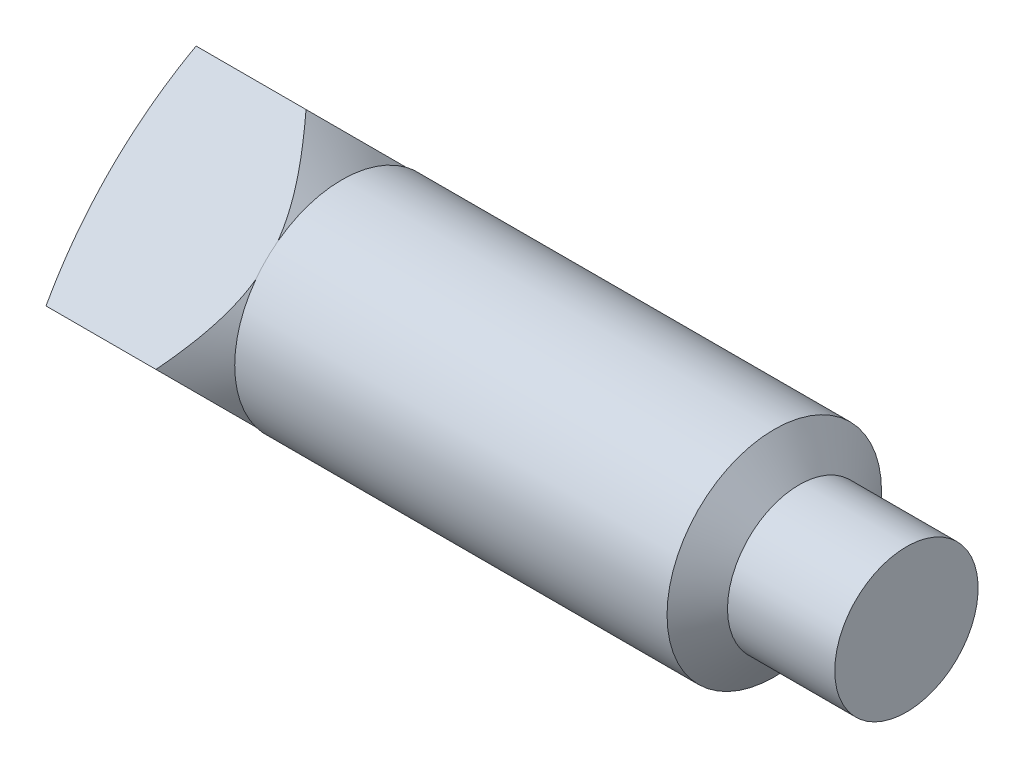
SolidWorks part; units mm, degrees
ref_plane "Plane1" through (0, 0, 0) normal (0, 0, 1) x (1, 0, 0)
ref_plane "Plane2" through (0, 0, 0) normal (0, 1, 0) x (1, 0, 0)
ref_plane "Plane3" through (0, 0, 0) normal (1, 0, 0) x (0, 0, -1)
sketch "BodySke" plane through (0, 0, 0) normal (0, 0, 1) x (1, 0, 0)
  line L0 (10.287, -1.6129) -> (12.7, -1.6129) construction
  line L1 (0, 0) -> (0, 2.413)
  line L2 (0, 2.413) -> (9.7268, 2.413)
  line L3 (12.7, 1.6129) -> (12.7, 0)
  line L4 (12.7, 0) -> (0, 0)
  line L5 (0, 0) -> (34.4106, 0) construction
  line L6 (0.7874, 3.175) -> (0.7874, -1.6129) construction
  line L7 (10.287, 1.6129) -> (12.7, 1.6129)
  line L8 (0, -2.413) -> (10.287, -2.413) construction
  line L9 (10.287, 1.6129) -> (9.7268, 2.413)
  line L10 (-2.413, 6.35) -> (-2.413, -1.6129) construction
  dimension "D1" = 125
  dimension "Length" = 12.7
  dimension "Diameter" = 4.826
  dimension "Dog_dia" = 3.2258
  dimension "Dog_len" = 2.413
  dimension "Advance" = 0.7874
  dimension "Thread_nom" = 12.7
revolve "BaseBody" add sketch "BodySke"
pattern_linear "ThdSchPat" [suppressed]
revolve "ThreadSchematic" cut sketch "ThdSchSke" angle 360 about L5
sketch "ThdSchSke" plane through (0, 0, 0) normal (0, 0, 1) x (1, 0, 0)
  line L0 (0.7874, -1.9406) -> (0.4566, -2.413)
  line L1 (0.7874, -1.9406) -> (1.1182, -2.413)
  line L2 (1.1182, -2.413) -> (1.1182, -3.0163)
  line L3 (-3.175, 0) -> (5.1513, 0) construction
  line L5 (1.1182, -3.0163) -> (0.4566, -3.0163)
  line L6 (0.4566, -3.0163) -> (0.4566, -2.413)
  dimension "D1" = 360
  dimension "Thread_minor" = 3.8811
  dimension "D2" = 1
  dimension "Diameter" = 4.826
  dimension "Start" = 0.7874
  dimension "D4" = 50
  dimension "SideAngle" = 55
  dimension "VeeAngle" = 70
  dimension "Overcut" = 6.0325
  dimension "Num_threads" = 13
  dimension "Advance" = 0.7307
sketch "Sketch4" plane through (0, 0, 0) normal (-1, 0, 0) x (0, -0.7071, 0.7071)
  line L1 (-2.3876, -2.3876) -> (2.3876, -2.3876)
  line L2 (-2.3876, -2.3876) -> (-2.3876, 2.3876)
  line L3 (-2.3876, 2.3876) -> (2.3876, 2.3876)
  line L4 (2.3876, -2.3876) -> (2.3876, 2.3876)
  dimension "D1" = 4.7752
  dimension "Width_flats" = 4.7752
  dimension "D2" = 2.3876
  dimension "D3" = 2.3876
extrude "BaseHead" add sketch "Sketch4" along normal blind 3.7592
sketch "Sketch5" plane through (0, 0, 0) normal (0, 0, 1) x (1, 0, 0)
  line L0 (-3.7592, 0) -> (-16.4592, 0)
  line L1 (0, 0) -> (57.15, 0) construction
  line L2 (0, 0) -> (34.4106, 0) construction
  line L3 (-16.4592, 0) -> (-16.4592, 3.3766)
  line L5 (-16.4592, 3.3766) -> (-3.2823, 3.3766)
  line L6 (-3.7592, 3.3766) -> (0, 3.3766) construction
  arc A0 (-3.2823, 3.3766) -> (-3.7592, 0) centre (8.4328, 0) ccw
  dimension "Head_radius" = 12.192
  dimension "D2" = 8.4328
  dimension "D3" = 12.7
revolve "HeadCrown" cut sketch "Sketch5" angle 360 about L1
sketch "Sketch6" plane through (0, 0, 0) normal (0, 0, 1) x (1, 0, 0)
  line L0 (0, 2.413) -> (-0.8085, 3.3766)
  line L1 (12.7, 2.413) -> (0, 2.413)
  line L3 (0, 1.9352) -> (0, 3.3766) construction
  line L4 (-3.2823, 3.3766) -> (0, 3.3766) construction
  line L5 (-0.8085, 3.3766) -> (-0.8085, 16.0766)
  line L7 (12.7, 2.413) -> (12.7, 16.0766)
  line L8 (12.7, 16.0766) -> (-0.8085, 16.0766)
  line L9 (0, 0) -> (60.325, 0) construction
  dimension "D1" = 40
  dimension "D2" = 12.7
  dimension "D3" = 12.7
  dimension "D4" = 2.413
revolve "HeadChamfer1" cut sketch "Sketch6" angle 360 about L9
equation "\"D1@Sketch4\" = \"Width_flats@Sketch4\""
equation "\"D2@Sketch4\" = \"Width_flats@Sketch4\" / 2"
equation "\"D3@Sketch4\" = \"Width_flats@Sketch4\" / 2"
equation "\"D2@Sketch5\" = \"Head_radius@Sketch5\" - \"Head_ht@BaseHead\""
equation "\"Thread_length@ThreadCosmetic\" = ((sgn( (\"Length@BodySke\" - \"Advance@BodySke\" - \"Dog_len@BodySke\" ) - \"Thread_nom@BodySke\" )-1)*( (\"Length@BodySke\" - \"Advance@BodySke\" - \"Dog_len@BodySke\" ) - \"Thread_"
equation "\"Thread_minor@ThdSchSke\" = \"Thread_minor@ThreadCosmetic\""
equation "\"Diameter@ThdSchSke\" = \"Diameter@BodySke\""
equation "\"Overcut@ThdSchSke\" = \"Diameter@BodySke\" * 1.25"
equation "\"Start@ThdSchSke\" = (\"Length@BodySke\" - \"Dog_len@BodySke\" ) - \"Thread_length@ThreadCosmetic\"  '---Non-countersunk---"
equation "\"Num_threads@ThdSchPat\" = int( \"Thread_length@ThreadCosmetic\" / \"Advance@BodySke\" + 0.999 )  + 1"
equation "\"Advance@ThdSchPat\" = \"Thread_length@ThreadCosmetic\" /  (\"Num_threads@ThdSchPat\" - 1) 'relax it"
equation "\"Num_threads@ThdSchPat\" = \"Num_threads@ThdSchPat\" - sgn( \"Num_threads@ThdSchPat\" - 1) '---chamfered tips only---"
equation "\"D4@Sketch6\" = \"Diameter@BodySke\" / 2.0"
